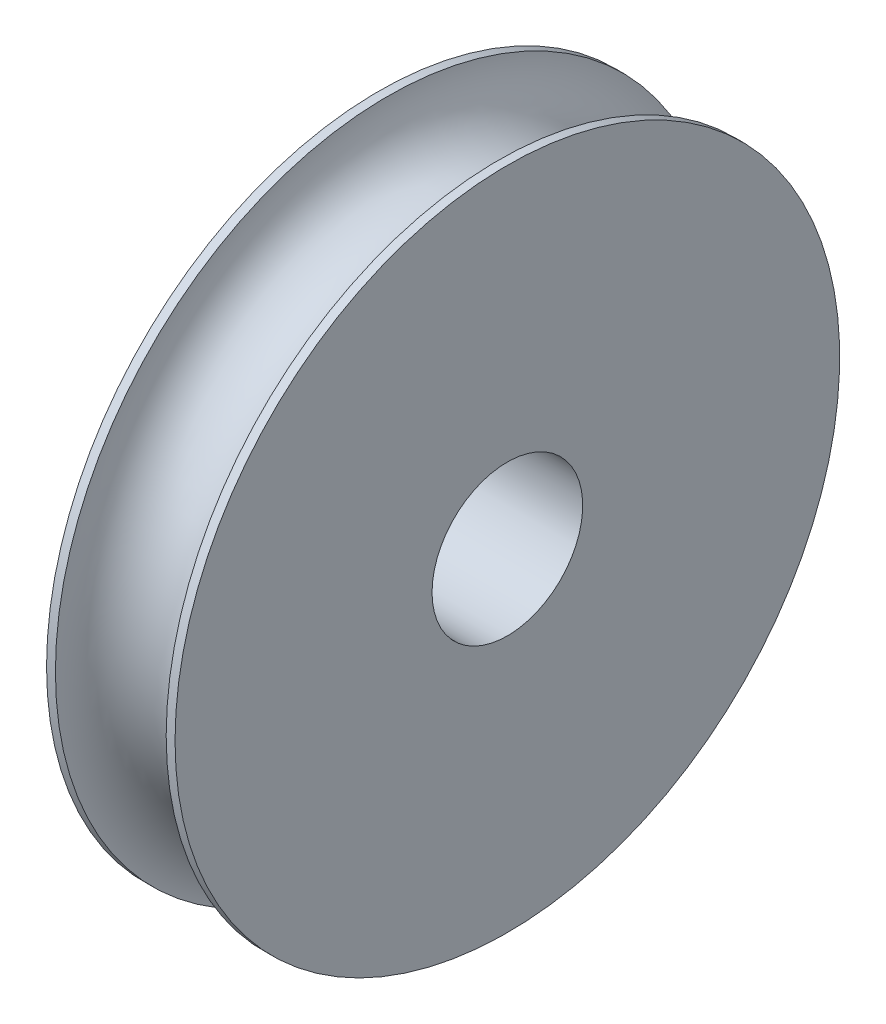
SolidWorks part; units mm, degrees
ref_plane "Plan de face" through (0, 0, 0) normal (0, 0, 1) x (1, 0, 0)
ref_plane "Plan de dessus" through (0, 0, 0) normal (0, 1, 0) x (1, 0, 0)
ref_plane "Plan de droite" through (0, 0, 0) normal (1, 0, 0) x (0, 0, -1)
sketch "Esquisse1" plane through (0, 0, 0) normal (0, 0, 1) x (1, 0, 0)
  line L0 (0, 0) -> (29, 0) construction
  line L1 (0, 17) -> (0, 75)
  line L2 (0, 75) -> (2, 75)
  line L3 (29, 75) -> (29, 17)
  line L4 (27, 75) -> (29, 75)
  line L5 (0, 17) -> (29, 17)
  arc A0 (2, 75) -> (27, 75) centre (14.5, 75) ccw
  dimension "D1" = 29
  dimension "D2" = 2
  dimension "D3" = 2
  dimension "D4" = 75
  dimension "D5" = 75
  dimension "D6" = 34
revolve "Révolution1" add sketch "Esquisse1" angle 360 about L0
